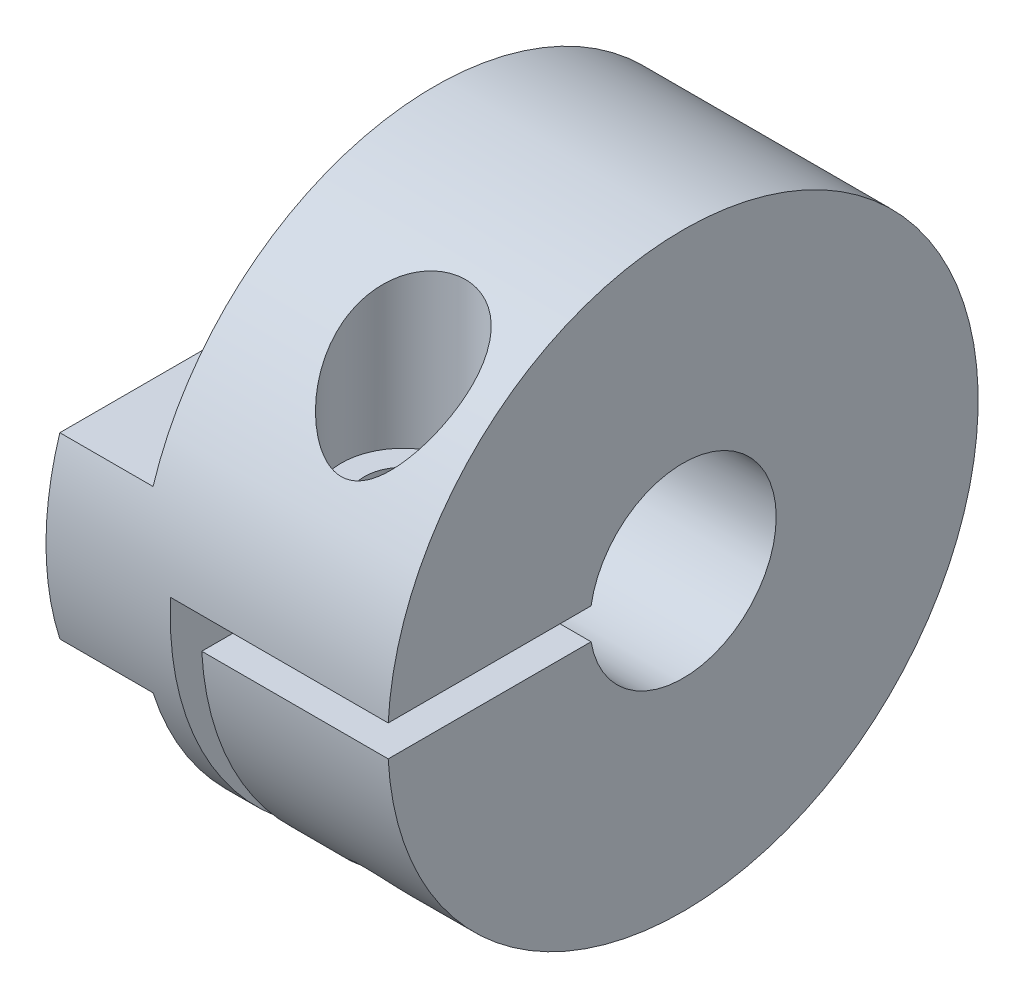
SolidWorks part; units mm, degrees
ref_plane "Plan1" through (0, 0, 0) normal (0, 0, 1) x (1, 0, 0)
ref_plane "Plan2" through (0, 0, 0) normal (0, 1, 0) x (1, 0, 0)
ref_plane "Plan3" through (0, 0, 0) normal (1, 0, 0) x (0, 0, -1)
sketch "Esquisse1" plane through (0, 0, 0) normal (0, 0, 1) x (1, 0, 0)
  line L0 (0, 0) -> (24.7291, 0) construction
  line L1 (0, 1.5) -> (0, 9.5)
  line L2 (0, 9.5) -> (11, 9.5)
  line L3 (11, 9.5) -> (11, 3)
  line L4 (11, 3) -> (4, 3)
  line L5 (4, 3) -> (4, 1.5)
  line L6 (4, 1.5) -> (0, 1.5)
  dimension "D1" = 9.5
  dimension "D2" = 3
  dimension "D3" = 11
  dimension "D4" = 1.5
  dimension "D5" = 7
revolve "Base-Révolution" add sketch "Esquisse1" angle 360 about L0
sketch "Esquisse2" plane through (0, 0, 0) normal (0, 0, 1) x (1, 0, 0)
  line L0 (-3.1407, 0) -> (12.8606, 0) construction
  line L1 (0, 0) -> (24.7291, 0) construction
  line L2 (0, 9.5) -> (0, -9.5) construction
  line L3 (0, 2.875) -> (3, 2.875)
  line L4 (0, 2.875) -> (0, 9.5)
  line L5 (0, 9.5) -> (3, 9.5)
  line L6 (3, 2.875) -> (3, 9.5)
  line L7 (11, 9.5) -> (0, 9.5) construction
  line L8 (3, -2.875) -> (3, -9.5)
  line L9 (0, -9.5) -> (3, -9.5)
  line L10 (0, -2.875) -> (0, -9.5)
  line L11 (0, -2.875) -> (3, -2.875)
  dimension "D1" = 3
  dimension "D2" = 2.875
extrude "Enlèv. mat.-Extru.1" cut sketch "Esquisse2" against normal mid plane 20
sketch "Esquisse3" plane through (0, 0, 0) normal (0, 1, 0) x (1, 0, 0)
  line L0 (11, 9.5) -> (0, 9.5) construction
  line L1 (4, -9.5) -> (5, -9.5)
  line L2 (4, -9.5) -> (4, 9.5)
  line L3 (4, 9.5) -> (5, 9.5)
  line L4 (5, -9.5) -> (5, 9.5)
  line L5 (3, 9.0545) -> (3, -9.0545) construction
  line L6 (0, -9.5) -> (11, -9.5) construction
  dimension "D1" = 1
  dimension "D2" = 1
extrude "Enlèv. mat.-Extru.2" cut sketch "Esquisse3" against normal through all
sketch "Esquisse4" plane through (11, 0, 0) normal (1, 0, 0) x (0, 0, -1)
  line L0 (0, 0) -> (-11.0166, 0) construction
  line L1 (-9.5, 0.5) -> (0, 0.5)
  line L2 (-9.5, 0.5) -> (-9.5, -0.5)
  line L3 (-9.5, -0.5) -> (0, -0.5)
  line L4 (0, 0.5) -> (0, -0.5)
  circle A0 centre (0, 0) radius 9.5 construction
  dimension "D1" = 1
extrude "Enlèv. mat.-Extru.3" cut sketch "Esquisse4" against normal blind 7
sketch "Esquisse5" plane through (0, 0, 0) normal (0, 1, 0) x (1, 0, 0)
  line L0 (11, -9.4868) -> (11, 9.5) construction
  line L1 (0, 0) -> (11.9937, 0) construction
  line L2 (0, 0) -> (24.7291, 0) construction
  circle A0 centre (8, -6) radius 1.25
  dimension "D1" = 2.5
  dimension "D2" = 3
  dimension "D3" = 6
extrude "Enlèv. mat.-Extru.4" cut sketch "Esquisse5" against normal mid plane 20
ref_plane "Plan4" through (0, 3.5, 0) normal (0, -1, 0) x (1, 0, 0)
sketch "Esquisse7" plane through (0, 3.5, 0) normal (0, -1, 0) x (1, 0, 0)
  circle A0 centre (8, 6) radius 2
  circle A1 centre (8, 6) radius 1.25 construction
  dimension "D1" = 4
extrude "Enlèv. mat.-Extru.6" cut sketch "Esquisse7" against normal up to next
sketch "Esq_WRNL_Compact001" plane through (0, 0, 0) normal (0, 0, 1) x (1, 0, 0)
  line L0 (-1, -10.5) -> (-1, 10.5)
  line L1 (12, -10.5) -> (12, 10.5)
  line L2 (-1, -10.5) -> (12, -10.5)
  line L3 (-1, 10.5) -> (12, 10.5)
